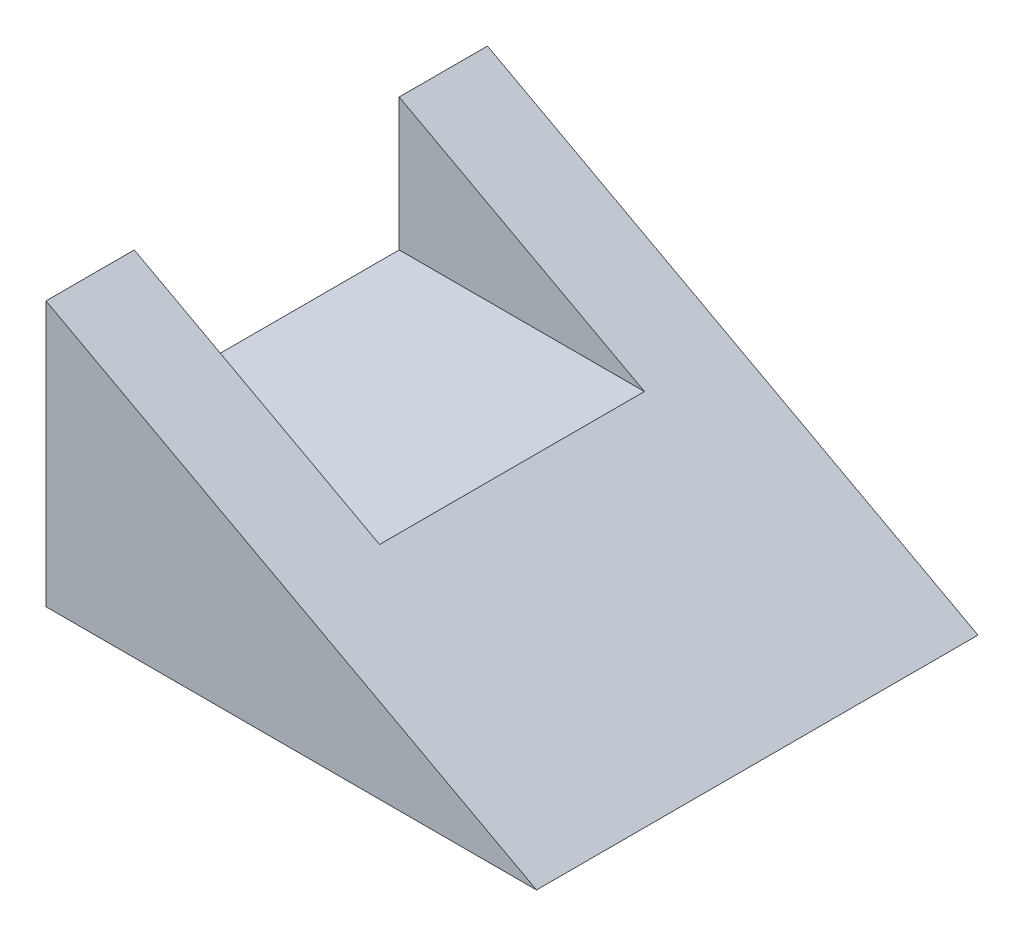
SolidWorks part; units mm, degrees
ref_plane "Plan de face" through (0, 0, 0) normal (0, 0, 1) x (1, 0, 0)
ref_plane "Plan de dessus" through (0, 0, 0) normal (0, 1, 0) x (1, 0, 0)
ref_plane "Plan de droite" through (0, 0, 0) normal (1, 0, 0) x (0, 0, -1)
sketch "Esquisse1" plane through (0, 0, 0) normal (0, 0, 1) x (1, 0, 0)
  line L0 (0, 0) -> (0, 27)
  line L1 (0, 27) -> (50, 0)
  line L2 (50, 0) -> (0, 0)
  dimension "D1" = 50
  dimension "D2" = 27
extrude "Extrusion1" add sketch "Esquisse1" along normal blind 45
sketch "Esquisse2" plane through (0, 0, 0) normal (-1, 0, 0) x (0, 0, 1)
  line L0 (45, 27) -> (0, 27) construction
  line L1 (9, 28.8571) -> (36, 28.8571)
  line L2 (9, 28.8571) -> (9, 13.5)
  line L3 (9, 13.5) -> (36, 13.5)
  line L4 (36, 28.8571) -> (36, 13.5)
  line L5 (0, 27) -> (0, 0) construction
  dimension "D1" = 13.5
  dimension "D2" = 9
  dimension "D3" = 27
extrude "Enlèv. mat.-Extru.1" cut sketch "Esquisse2" against normal through all
